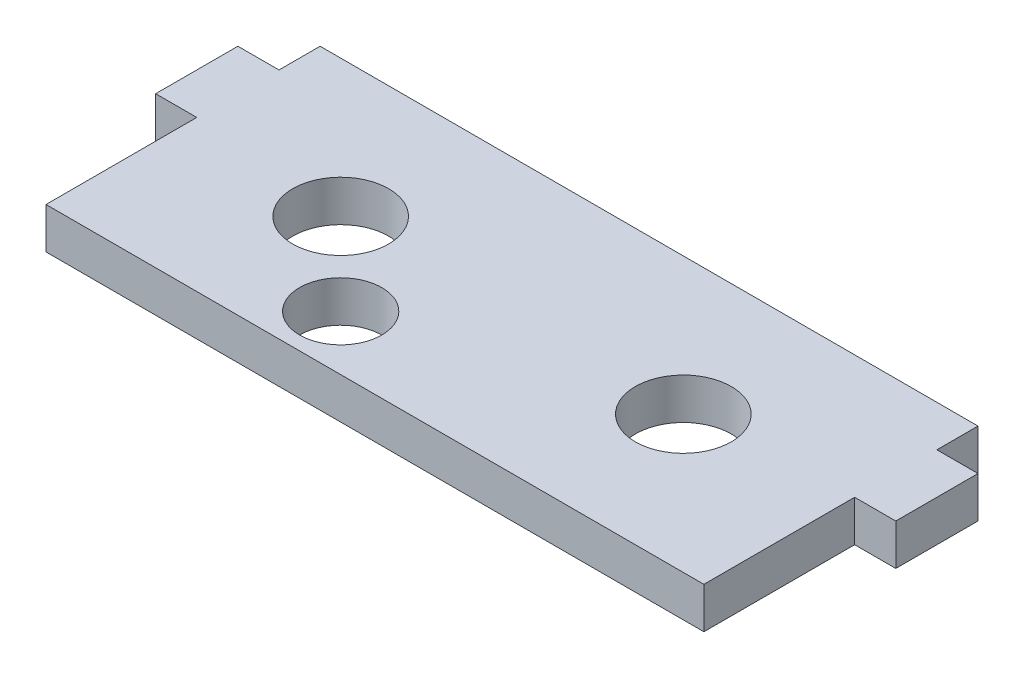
SolidWorks part; units mm, degrees
ref_plane "Front Plane" through (0, 0, 0) normal (0, 0, 1) x (1, 0, 0)
ref_plane "Top Plane" through (0, 0, 0) normal (0, 1, 0) x (1, 0, 0)
ref_plane "Right Plane" through (0, 0, 0) normal (1, 0, 0) x (0, 0, -1)
sketch "Sketch1" plane through (0, 0, 0) normal (0, 1, 0) x (1, 0, 0)
  line L1 (-24, 10) -> (24, 10)
  line L2 (-24, 10) -> (-24, -10)
  line L3 (-24, -10) -> (24, -10)
  line L4 (24, 10) -> (24, -10)
  line L5 (-24, 10) -> (24, -10) construction
  line L6 (-24, -10) -> (24, 10) construction
  point P0 (0, 0)
  dimension "D1" = 20
  dimension "D2" = 48
extrude "Boss-Extrude1" add sketch "Sketch1" along normal blind 3
sketch "Sketch2" plane through (0, 0, 0) normal (0, 1, 0) x (1, 0, 0)
  line L0 (0, 0) -> (0, 3.5903) construction
  line L1 (-24, 4) -> (-25.5, 4) construction
  line L2 (-24, 10) -> (-24, -10) construction
  line L3 (27, 1) -> (24, 7) construction
  line L4 (-27, 7) -> (-24, 7)
  line L5 (-27, 7) -> (-27, 1)
  line L6 (-27, 1) -> (-24, 1)
  line L7 (-24, 7) -> (-24, 1)
  line L8 (-27, 7) -> (-24, 1) construction
  line L9 (-27, 1) -> (-24, 7) construction
  line L10 (27, 7) -> (24, 1) construction
  line L11 (24, 4) -> (25.5, 4) construction
  line L12 (24, 7) -> (24, 1)
  line L13 (27, 1) -> (24, 1)
  line L14 (27, 7) -> (27, 1)
  line L15 (27, 7) -> (24, 7)
  line L16 (24, 10) -> (-24, 10) construction
  dimension "D1" = 3
  dimension "D2" = 6
  dimension "D3" = 3
extrude "Boss-Extrude2" add sketch "Sketch2" along normal blind 3
sketch "Sketch3" plane through (0, 0, 0) normal (0, 1, 0) x (1, 0, 0)
  line L0 (0, 0) -> (0, -6) construction
  line L1 (0, -6) -> (-6.5, -6) construction
  line L2 (-12.5, 0) -> (12.5, 0) construction
  circle A0 centre (-6.5, -6) radius 3
  circle A1 centre (-12.5, 0) radius 3.5
  circle A2 centre (12.5, 0) radius 3.5
  point P7 (0, 0)
  dimension "D1" = 6
  dimension "D5" = 7
  dimension "D2" = 6.5
  dimension "D3" = 6
  dimension "D4" = 25
extrude "Cut-Extrude1" cut sketch "Sketch3" along normal blind 3
